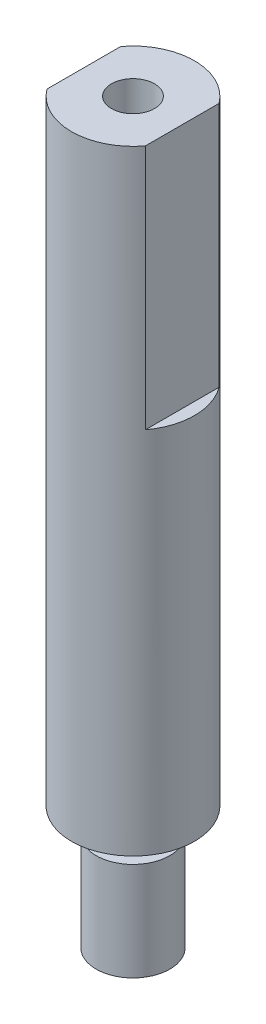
SolidWorks part; units mm, degrees
ref_plane "Front Plane" through (0, 0, 0) normal (0, 0, 1) x (1, 0, 0)
ref_plane "Top Plane" through (0, 0, 0) normal (0, 1, 0) x (1, 0, 0)
ref_plane "Right Plane" through (0, 0, 0) normal (1, 0, 0) x (0, 0, -1)
sketch "Sketch1" plane through (0, 0, 0) normal (0, 0, 1) x (1, 0, 0)
  line L0 (0, 52.9432) -> (0, -37.8551) construction
  line L1 (0, 0) -> (2.5, 0)
  line L2 (2.5, 0) -> (2.5, 25)
  line L3 (2.5, 25) -> (0, 25)
  line L4 (0, 0) -> (0, 25)
revolve "Revolve1" add sketch "Sketch1" angle 360 about L0
sketch "Sketch2" plane through (0, 25, 0) normal (0, 1, 0) x (1, 0, 0)
  line L0 (0, 0) -> (0, 2.5) construction
  line L1 (0, 0) -> (0, -2.5) construction
  line L2 (0, 0) -> (-2.5, 0) construction
  line L3 (0, 0) -> (2.5, 0) construction
  line L5 (-1.9999, 0) -> (-1.9999, -1.5002)
  line L6 (-1.9999, 0) -> (-1.9999, 1.5002)
  line L7 (2.0033, 0) -> (2.0033, -1.4955)
  line L8 (2.0033, 0) -> (2.0033, 1.4955)
  circle A2 centre (0, 0) radius 2.5 construction
extrude "Cut-Extrude3" cut sketch "Sketch2" against normal blind 10
hole_wizard "M2.2x0.45 Tapped Hole1" positions "3DSketch1" profile "Sketch3" tap size "M2.2x0.45" standard "ISO"
sketch3d "3DSketch1"
  point P0 (0, 25, 0)
sketch "Sketch3" plane through (0, 25, 0) normal (1, 0, 0) x (0, 0, 1)
  line L0 (0, 0) -> (0, 4.0258)
  line L1 (0, 4.0258) -> (0.875, 3.5)
  line L2 (0.875, 3.5) -> (0.875, 0)
  line L5 (0.875, 0) -> (0, 0)
  line L10 (0, 4.0258) -> (-0.875, 3.5) construction
  line L11 (0, -6.35) -> (0, 107.95) construction
  dimension "Tap Drill Dia." = 1.75
  dimension "Tap Drill Depth" = 3.5
  dimension "Drill Angle" = 118
sketch "Sketch4" plane through (0, 0, 0) normal (0, -1, 0) x (1, 0, 0)
  circle A0 centre (0, 0) radius 1
extrude "Extrude1" add sketch "Sketch4" along normal blind 1
sketch "Sketch5" plane through (0, -1, 0) normal (0, -1, 0) x (1, 0, 0)
  circle A0 centre (0, 0) radius 1.5
extrude "Extrude2" add sketch "Sketch5" along normal blind 4
